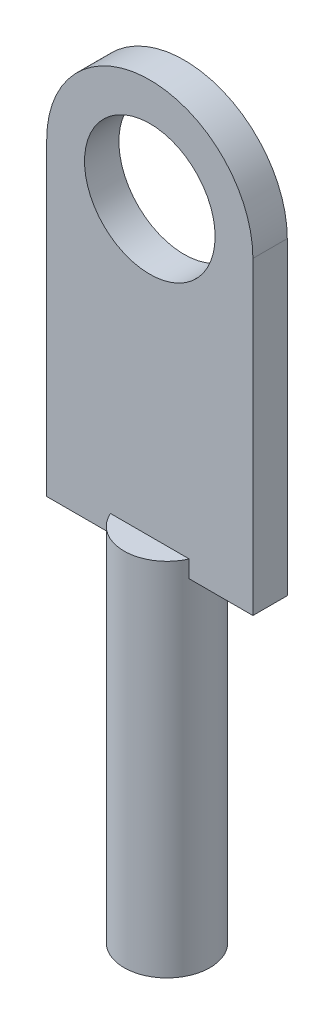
SolidWorks part; units mm, degrees
ref_plane "Front Plane" through (0, 0, 0) normal (0, 0, 1) x (1, 0, 0)
ref_plane "Top Plane" through (0, 0, 0) normal (0, 1, 0) x (1, 0, 0)
ref_plane "Right Plane" through (0, 0, 0) normal (1, 0, 0) x (0, 0, -1)
sketch "Sketch1" plane through (0, 0, 0) normal (0, 1, 0) x (1, 0, 0)
  circle A0 centre (0, 0) radius 1.5875
  dimension "D1" = 3.175
extrude "Boss-Extrude1" add sketch "Sketch1" along normal blind 8.255
sketch "Sketch2" plane through (0, 0, 0) normal (0, 0, 1) x (1, 0, 0)
  line L0 (-3.81, 19.05) -> (-3.81, 7.62)
  line L1 (-3.81, 7.62) -> (3.81, 7.62)
  line L2 (3.81, 19.05) -> (3.81, 7.62)
  line L4 (1.5875, 8.255) -> (-1.5875, 8.255) construction
  arc A0 (3.81, 19.05) -> (-3.81, 19.05) centre (0, 19.05) ccw
  circle A1 centre (0, 19.05) radius 2.413
  dimension "D1" = 4.826
  dimension "D2" = 7.62
  dimension "D3" = 19.05
  dimension "D4" = 0.635
extrude "Boss-Extrude2" add sketch "Sketch2" along normal mid plane 1.27
sketch "Sketch3" plane through (0, 0, 0) normal (0, -1, 0) x (1, 0, 0)
  circle A0 centre (0, 0) radius 1.5875
extrude "Boss-Extrude3" add sketch "Sketch3" along normal blind 5.08
